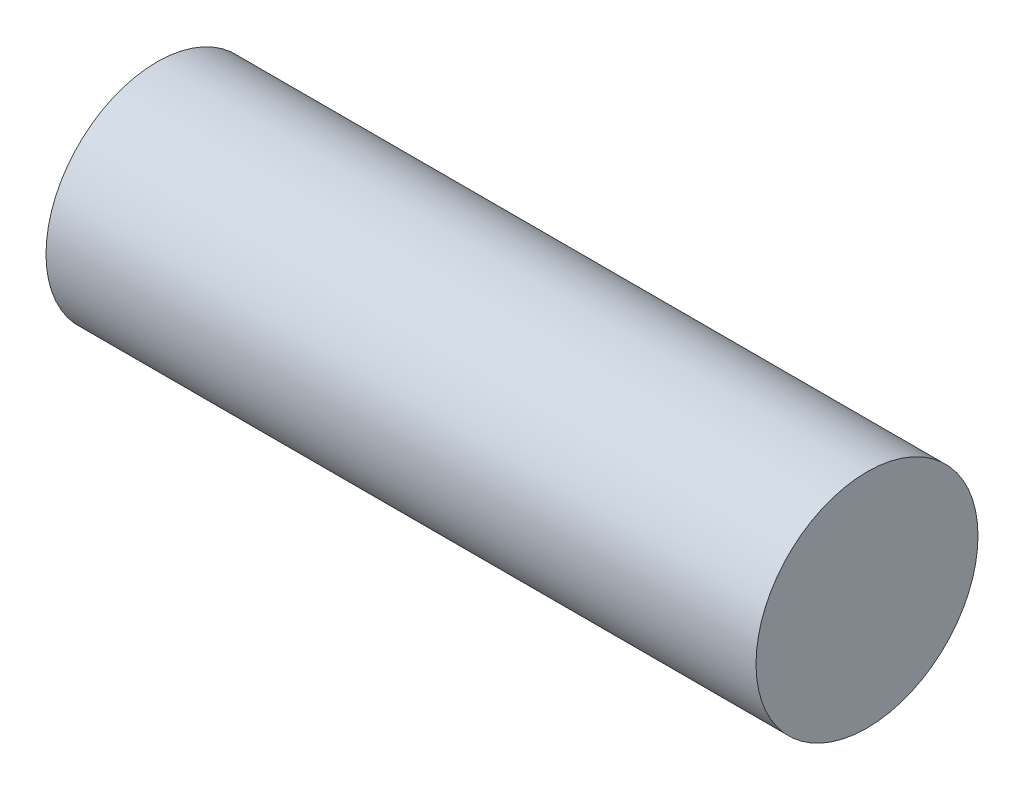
SolidWorks part; units mm, degrees
ref_plane "Front Plane" through (0, 0, 0) normal (0, 0, 1) x (1, 0, 0)
ref_plane "Top Plane" through (0, 0, 0) normal (0, 1, 0) x (1, 0, 0)
ref_plane "Right Plane" through (0, 0, 0) normal (1, 0, 0) x (0, 0, -1)
sketch "Sketch2" plane through (0, 0, 0) normal (1, 0, 0) x (0, 0, -1)
  circle A0 centre (0, 0) radius 3
  dimension "D1" = 6
extrude "Boss-Extrude1" add sketch "Sketch2" along normal blind 19.19 contours A0
